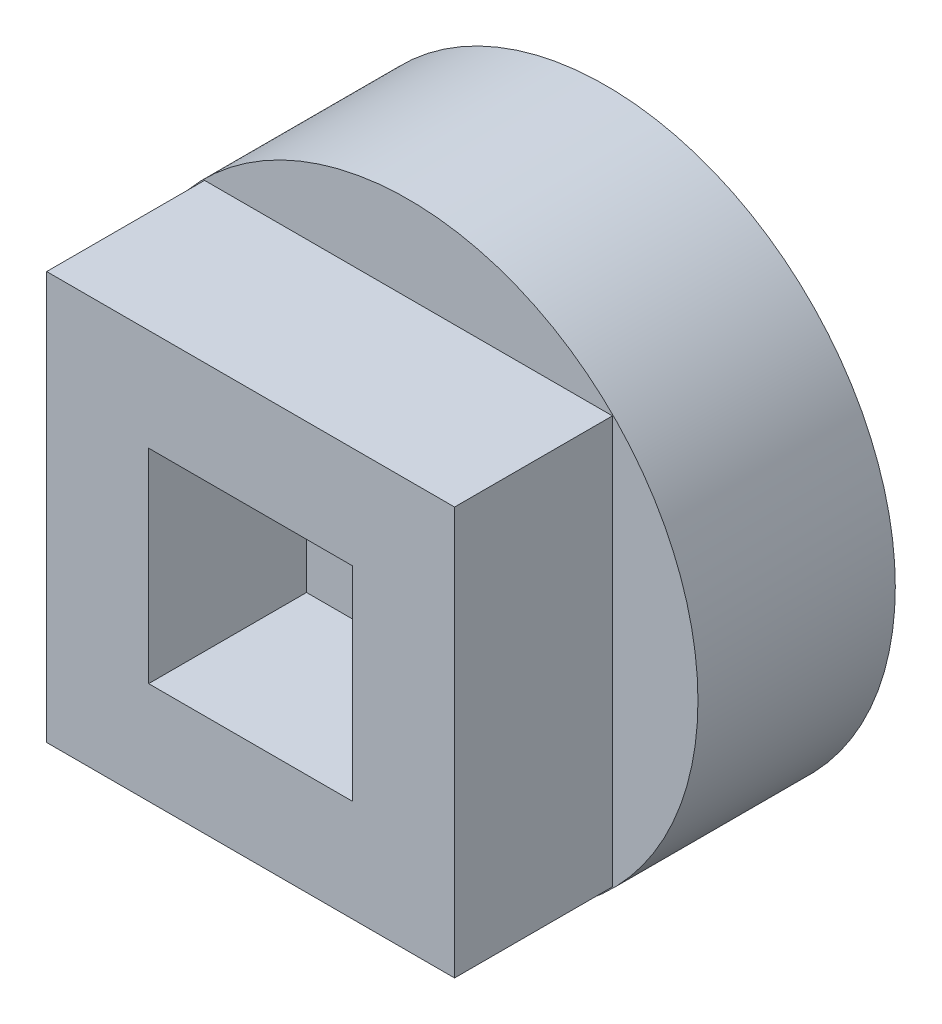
SolidWorks part; units mm, degrees
ref_plane "Front Plane" through (0, 0, 0) normal (0, 0, 1) x (1, 0, 0)
ref_plane "Top Plane" through (0, 0, 0) normal (0, 1, 0) x (1, 0, 0)
ref_plane "Right Plane" through (0, 0, 0) normal (1, 0, 0) x (0, 0, -1)
sketch "Sketch1" plane through (0, 0, 0) normal (0, 0, 1) x (1, 0, 0)
  circle A0 centre (0, 0) radius 11
  dimension "D1" = 22
extrude "Boss-Extrude1" add sketch "Sketch1" along normal blind 7.5 contours A0
sketch "Sketch2" plane through (0, 0, 7.5) normal (0, 0, 1) x (1, 0, 0)
  line L1 (-7.75, 7.75) -> (7.75, 7.75)
  line L2 (-7.75, 7.75) -> (-7.75, -7.75)
  line L3 (-7.75, -7.75) -> (7.75, -7.75)
  line L4 (7.75, 7.75) -> (7.75, -7.75)
  point P4 (7.75, 0)
  point P6 (0, 7.75)
  dimension "D1" = 15.5
  dimension "D2" = 15.5
extrude "Boss-Extrude2" add sketch "Sketch2" along normal blind 6
sketch "Sketch3" plane through (0, 0, 13.5) normal (0, 0, 1) x (1, 0, 0)
  line L1 (-3.875, 3.875) -> (3.875, 3.875)
  line L2 (-3.875, 3.875) -> (-3.875, -3.875)
  line L3 (-3.875, -3.875) -> (3.875, -3.875)
  line L4 (3.875, 3.875) -> (3.875, -3.875)
  point P4 (0, 3.875)
  point P6 (-3.875, 0)
  dimension "D1" = 7.75
  dimension "D2" = 7.75
extrude "Cut-Extrude1" cut sketch "Sketch3" against normal up to surface (6 mm away)
